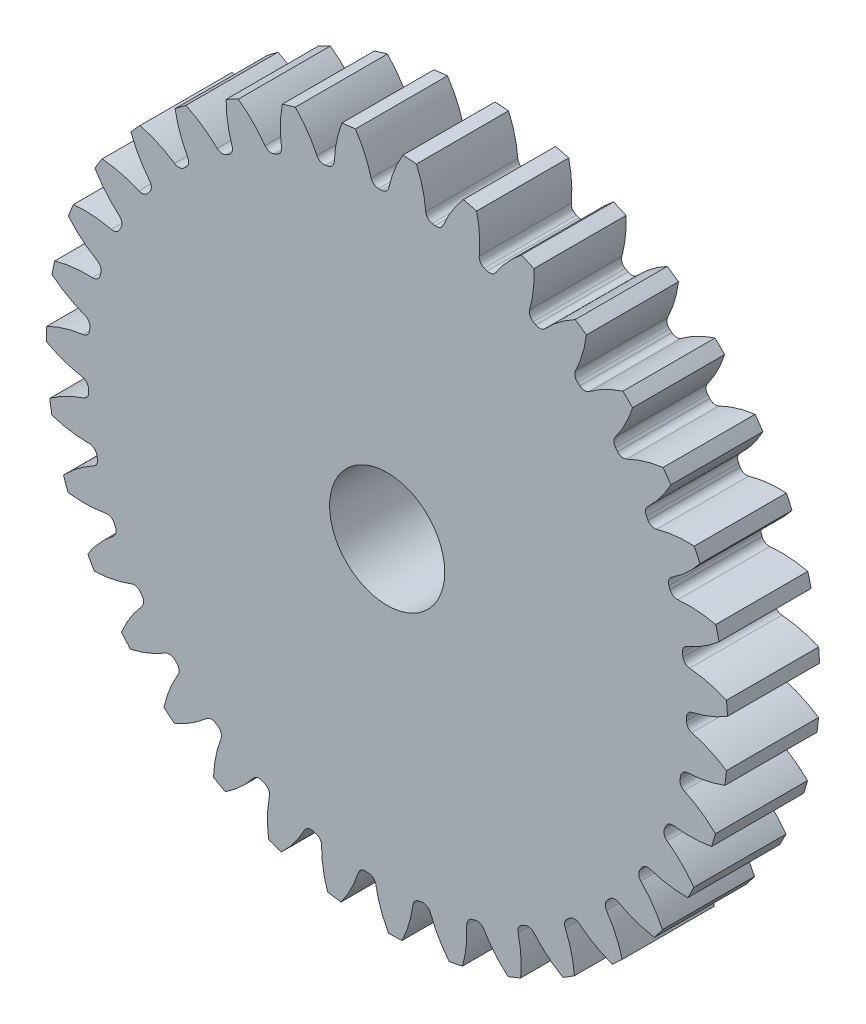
SolidWorks part; units mm, degrees
ref_plane "Front" through (0, 0, 0) normal (0, 0, 1) x (1, 0, 0)
ref_plane "Top" through (0, 0, 0) normal (0, 1, 0) x (1, 0, 0)
ref_plane "Right" through (0, 0, 0) normal (1, 0, 0) x (0, 0, -1)
sketch "Sketch3" plane through (0, 0, 0) normal (0, 0, 1) x (1, 0, 0)
  circle A0 centre (0, 0) radius 375.92
  dimension "od" = 751.84
extrude "gearBody" add sketch "Sketch3" along normal blind 101.6
sketch "Sketch2" plane through (0, 0, 0) normal (0, 0, 1) x (1, 0, 0)
  line L0 (0, 0) -> (308.7187, 127.8755) construction
  line L1 (374.791, -34.4885) -> (0, 0) construction
  line L2 (0, 0) -> (36.3143, 0) construction
  line L3 (355.5025, 8.3253) -> (354.8251, -23.4622) construction
  line L5 (355.1638, -7.5684) -> (0, 0) construction
  line L7 (0, 0) -> (334.1547, 0) construction
  arc A0 (334.1485, 2.0411) -> (333.7582, -16.274) centre (0, 0) ccw construction
  arc A1 (375.4782, 18.2208) -> (374.3611, -34.1997) centre (0, 0) ccw construction
  arc A2 (355.5025, 8.3253) -> (354.8251, -23.4622) centre (0, 0) ccw construction
  arc A3 (330.0854, -8.6992) -> (330.1563, -5.3703) centre (0, 0) ccw
  arc A4 (374.791, -34.4885) -> (336.2126, -16.9056) centre (302.9909, -140.9108) ccw
  arc A5 (374.791, -34.4885) -> (375.92, 18.491) centre (0, 0) ccw
  arc A6 (375.92, 18.491) -> (336.6276, 2.5676) centre (308.7187, 127.8755) cw
  arc A7 (330.1563, -5.3703) -> (336.6276, 2.5676) centre (338.4255, -5.5049) cw
  arc A8 (336.2126, -16.9056) -> (330.0854, -8.6992) centre (338.3528, -8.9171) cw
  point P6 (375.92, 18.491)
  point P22 (374.791, -34.4885)
  dimension "baseDia" = 668.3094
  dimension "od" = 751.84
  dimension "pd" = 711.2
  dimension "rd" = 660.4
  dimension "rFillet" = 8.2702
  dimension "pointX" = 375.92
  dimension "pointY" = 18.491
  dimension "CTT" = 31.7875
  dimension "flankCenterAngle" = 22.5
extrude "toothCut" cut sketch "Sketch2" along normal through all
pattern_circular "CirPattern1" count 35 over 360 about axis through (0, 0, 0) along (0, 0, 1) of "toothCut"
sketch "hub1Dia" plane through (0, 0, 0) normal (0, 0, -1) x (-1, 0, 0)
  circle A0 centre (0, 0) radius 12.7
  dimension "hub1Dia" = 25.4
sketch "hub2Dia" plane through (0, 0, 101.6) normal (0, 0, 1) x (1, 0, 0)
  circle A0 centre (0, 0) radius 12.7
  dimension "hub2dia" = 25.4
sketch "boreDia" plane through (0, 0, 0) normal (0, 0, 1) x (1, 0, 0)
  circle A0 centre (0, 0) radius 63.5
  dimension "boreDia" = 127
extrude "bore" cut sketch "boreDia" against normal mid plane 25400
